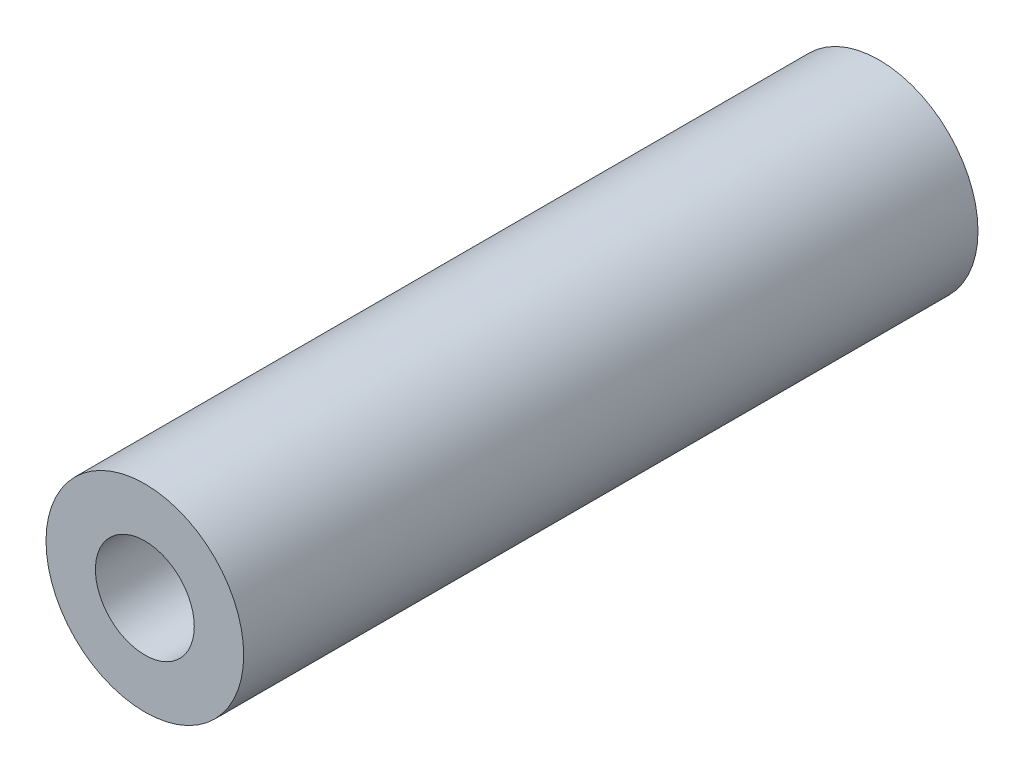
SolidWorks part; units mm, degrees
ref_plane "Plan de face" through (0, 0, 0) normal (0, 0, 1) x (1, 0, 0)
ref_plane "Plan de dessus" through (0, 0, 0) normal (0, 1, 0) x (1, 0, 0)
ref_plane "Plan de droite" through (0, 0, 0) normal (1, 0, 0) x (0, 0, -1)
sketch "Esquisse1" plane through (0, 0, 0) normal (0, 0, 1) x (1, 0, 0)
  circle A0 centre (0, 0) radius 1.75
  circle A1 centre (0, 0) radius 3.5
  dimension "D1" = 7
  dimension "D2" = 3.5
extrude "Extrusion1" add sketch "Esquisse1" against normal blind 26
